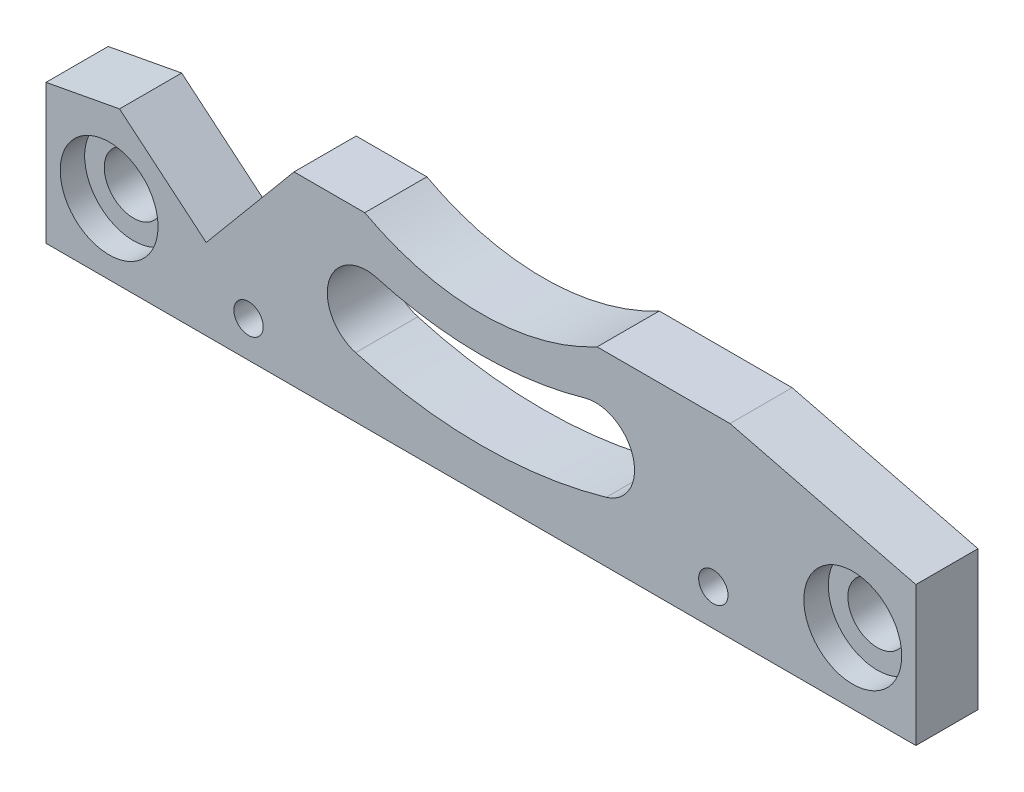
SolidWorks part; units mm, degrees
ref_plane "Front Plane" through (0, 0, 0) normal (0, 0, 1) x (1, 0, 0)
ref_plane "Top Plane" through (0, 0, 0) normal (0, 1, 0) x (1, 0, 0)
ref_plane "Right Plane" through (0, 0, 0) normal (1, 0, 0) x (0, 0, -1)
sketch "Sketch1" plane through (0, 0, 0) normal (0, 0, 1) x (1, 0, 0)
  line L0 (-44.45, 0) -> (44.45, 0)
  line L1 (-44.45, 0) -> (-44.45, 14.25)
  line L2 (44.45, 0) -> (44.45, 14.25)
  line L3 (0, 0) -> (0, 30.3132) construction
  line L4 (-44.45, 14.25) -> (-36.9332, 15.6585)
  line L5 (-36.9332, 15.6585) -> (-28.0779, 8.2577)
  line L6 (44.45, 14.25) -> (25.45, 19)
  line L7 (25.45, 19) -> (-19.1, 19)
  line L9 (-28.0779, 8.2577) -> (-19.1, 19)
  line L10 (-36.9332, 15.6585) -> (-19.1, 19) construction
  dimension "D1" = 88.9
  dimension "D2" = 14.25
  dimension "D3" = 19
  dimension "D4" = 19
  dimension "D5" = 44.55
  dimension "D7" = 14
  dimension "D9" = 129.5
extrude "Boss-Extrude1" add sketch "Sketch1" along normal mid plane 6.35
hole_wizard "CBORE for M6 SBHCS2" positions "Sketch6" profile "Sketch7" counterbore size "M6" standard "ANSI Metric"
sketch "Sketch6" plane through (0, 0, 3.175) normal (0, 0, 1) x (1, 0, 0)
  line L4 (-44.45, 0) -> (44.45, 0) construction
  line L5 (-44.45, 14.25) -> (-44.45, 0) construction
  point P0 (-38, 7.2)
  dimension "D1" = 7.2
  dimension "D2" = 6.45
sketch "Sketch7" plane through (-38, 7.2, 3.175) normal (1, 0, 0) x (0, -1, 0)
  line L0 (0, 0) -> (0, 6.35)
  line L1 (0, 6.35) -> (3, 6.35)
  line L3 (3, 6.35) -> (3, 2.5)
  line L4 (3, 2.5) -> (5, 2.5)
  line L5 (5, 2.5) -> (5, 0)
  line L7 (5, 0) -> (0, 0)
  line L11 (0, -6.35) -> (0, 107.95) construction
  dimension "Thru Hole Dia." = 6
  dimension "Thru Hole Depth" = 6.35
  dimension "C'Bore Dia." = 10
  dimension "C'Bore Depth" = 2.5
mirror "Mirror1" about plane through (0, 0, 0) normal (1, 0, 0) of "CBORE for M6 SBHCS2"
hole_wizard "Ø3.0 (3) Diameter Hole1" positions "Sketch9" profile "Sketch8" hole size "Ø3.0" standard "ANSI Metric"
sketch "Sketch9" plane through (0, 0, 3.175) normal (0, 0, 1) x (1, 0, 0)
  circle A0 centre (-38, 7.2) radius 5 construction
  point P0 (-23.75, 3.7)
  dimension "D1" = 14.25
  dimension "D2" = 3.5
sketch "Sketch8" plane through (-23.75, 3.7, 3.175) normal (1, 0, 0) x (0, -1, 0)
  line L0 (0, 0) -> (0, 6.35)
  line L1 (0, 6.35) -> (1.5, 6.35)
  line L2 (1.5, 6.35) -> (1.5, 0)
  line L5 (1.5, 0) -> (0, 0)
  line L11 (0, -6.35) -> (0, 107.95) construction
  dimension "Thru Hole Dia." = 3
  dimension "Thru Hole Depth" = 6.35
mirror "Mirror2" about plane through (0, 0, 0) normal (1, 0, 0) of "Ø3.0 (3) Diameter Hole1"
sketch "Sketch10" plane through (0, 0, 3.175) normal (0, 0, 1) x (1, 0, 0)
  line L0 (0, 0) -> (0, 48.0329) construction
  line L2 (-44.45, 0) -> (44.45, 0) construction
  arc A0 (11.7008, 9.9944) -> (-11.7008, 9.9944) centre (0, 50.8) cw construction
  arc A1 (-12.8034, 6.1494) -> (12.8034, 6.1494) centre (0, 50.8) ccw
  arc A2 (-10.5983, 13.8395) -> (10.5983, 13.8395) centre (0, 50.8) ccw
  arc A3 (-10.5983, 13.8395) -> (-12.8034, 6.1494) centre (-11.7008, 9.9944) ccw
  arc A4 (12.8034, 6.1494) -> (10.5983, 13.8395) centre (11.7008, 9.9944) ccw
  point P3 (0, 8.35)
  dimension "D1" = 4
  dimension "D3" = 42.45
  dimension "D4" = 8.35
  dimension "D2" = 32
extrude "Cut-Extrude1" cut sketch "Sketch10" against normal up to next
sketch "Sketch11" plane through (0, 0, 3.175) normal (0, 0, 1) x (1, 0, 0)
  line L1 (25.45, 19) -> (-19.1, 19) construction
  line L2 (11.8743, 19) -> (-11.8743, 19)
  line L3 (0, 0) -> (0, 30.6108) construction
  arc A0 (-11.8743, 19) -> (11.8743, 19) centre (0, 41) ccw
  dimension "D1" = 22
  dimension "D2" = 25
extrude "Cut-Extrude2" cut sketch "Sketch11" against normal up to next
